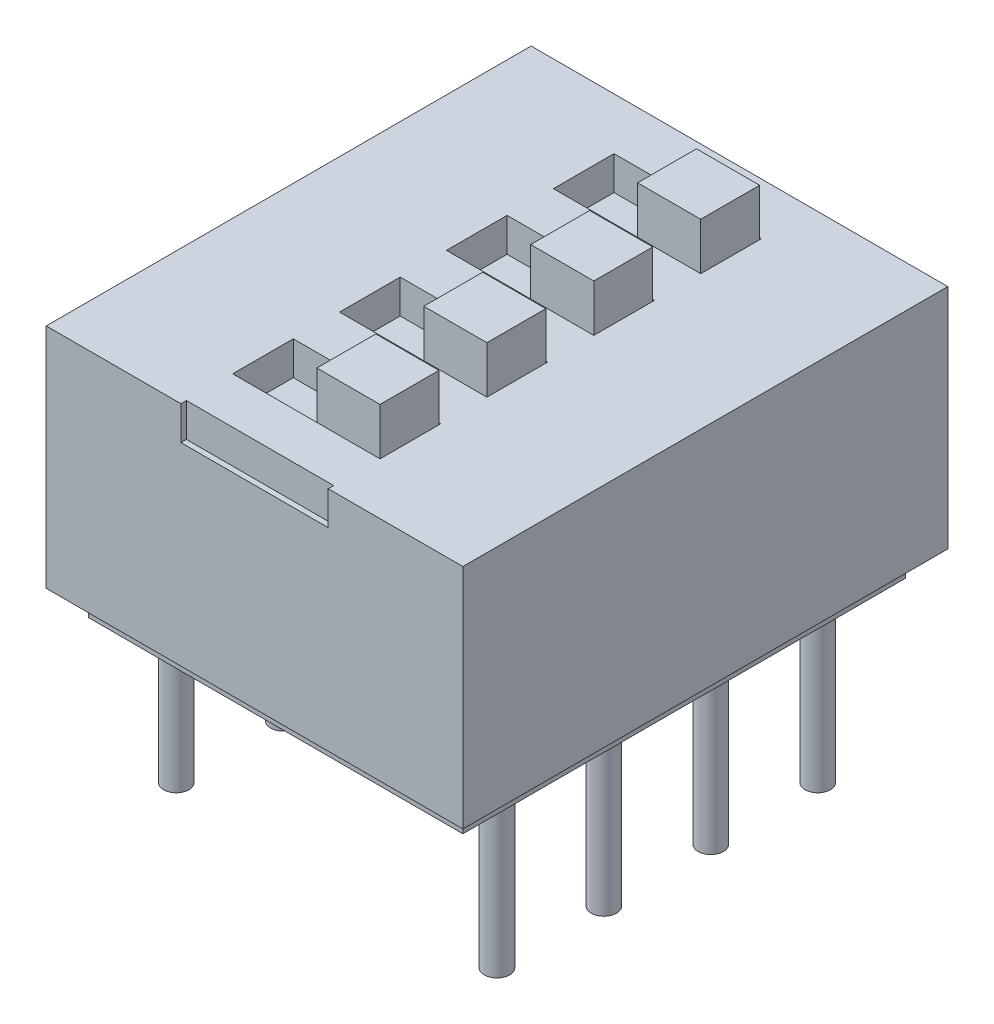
SolidWorks part; units mm, degrees
ref_plane "Plan de face" through (0, 0, 0) normal (0, 0, 1) x (1, 0, 0)
ref_plane "Plan de dessus" through (0, 0, 0) normal (0, 1, 0) x (1, 0, 0)
ref_plane "Plan de droite" through (0, 0, 0) normal (1, 0, 0) x (0, 0, -1)
sketch "Esquisse1" plane through (0, 0, 0) normal (0, 0, 1) x (1, 0, 0)
  line L0 (-9.541, 0) -> (21.5285, 0) construction
  line L1 (0, -1.2116) -> (0, 23.1187) construction
  line L2 (-4.95, -3.792) -> (-4.95, 12.2258) construction
  line L3 (-9.541, 5.4) -> (21.5285, 5.4) construction
  line L4 (4.95, -3.792) -> (4.95, 12.2258) construction
  line L6 (-4.95, 5.4) -> (4.95, 5.4)
  line L7 (-4.95, 5.4) -> (-4.95, 0)
  line L8 (-4.95, 0) -> (4.95, 0)
  line L9 (4.95, 5.4) -> (4.95, 0)
  dimension "D1" = 4.95
  dimension "D2" = 9.9
  dimension "D3" = 5.4
extrude "Boss.-Extru.1" add sketch "Esquisse1" along normal blind 11.52
sketch "Esquisse2" plane through (0, 5.4, 0) normal (0, 1, 0) x (1, 0, 0)
  line L0 (-7.5233, 0) -> (6.4204, 0) construction
  line L1 (-3.381, -1.95) -> (6.4204, -1.95) construction
  line L2 (0, 0.9083) -> (0, -14.5675) construction
  line L3 (-7.5233, -1.23) -> (3.0824, -1.23) construction
  line L4 (-1.75, 2.1221) -> (-1.75, -3.3399) construction
  line L5 (1.75, 2.1221) -> (1.75, -3.3399) construction
  line L6 (-7.5233, -2.67) -> (3.0824, -2.67) construction
  line L7 (-1.75, -3.77) -> (1.75, -3.77)
  line L8 (-1.75, -1.23) -> (1.75, -1.23)
  line L9 (-1.75, -1.23) -> (-1.75, -2.67)
  line L10 (-1.75, -2.67) -> (1.75, -2.67)
  line L11 (1.75, -1.23) -> (1.75, -2.67)
  line L12 (-1.75, -3.77) -> (-1.75, -5.21)
  line L13 (-1.75, -5.21) -> (1.75, -5.21)
  line L14 (1.75, -3.77) -> (1.75, -5.21)
  line L15 (-1.75, -6.31) -> (1.75, -6.31)
  line L16 (-1.75, -6.31) -> (-1.75, -7.75)
  line L17 (-1.75, -7.75) -> (1.75, -7.75)
  line L18 (1.75, -6.31) -> (1.75, -7.75)
  line L19 (-1.75, -8.85) -> (1.75, -8.85)
  line L20 (-1.75, -8.85) -> (-1.75, -10.29)
  line L21 (-1.75, -10.29) -> (1.75, -10.29)
  line L22 (1.75, -8.85) -> (1.75, -10.29)
  line L23 (-1.75, -11.39) -> (1.75, -11.39)
  line L24 (-1.75, -11.39) -> (-1.75, -12.83)
  line L25 (-1.75, -12.83) -> (1.75, -12.83)
  line L26 (1.75, -11.39) -> (1.75, -12.83)
  dimension "D1" = 1.95
  dimension "D2" = 1.44
  dimension "D3" = 3.5
  dimension "D4" = 1.75
  dimension "D5" = 0.72
  dimension "D6" = 5
extrude "Enlèv. mat.-Extru.1" cut sketch "Esquisse2" against normal blind 0.8
sketch "Esquisse3" plane through (0, 4.6, 0) normal (0, 1, 0) x (1, 0, 0)
  line L0 (2.2148, -1.95) -> (-0.4475, -1.95) construction
  line L1 (2.2148, -1.25) -> (-0.4012, -1.25) construction
  line L2 (2.2148, -2.65) -> (-0.3664, -2.65) construction
  line L3 (1.73, -1.0106) -> (1.73, -2.8221) construction
  line L4 (0.23, -1.0106) -> (0.23, -2.8221) construction
  line L5 (1.75, -2.67) -> (1.75, -1.23) construction
  line L6 (0.23, -3.79) -> (0.23, -5.19)
  line L7 (0.23, -1.25) -> (1.73, -1.25)
  line L8 (0.23, -1.25) -> (0.23, -2.65)
  line L9 (0.23, -2.65) -> (1.73, -2.65)
  line L10 (1.73, -1.25) -> (1.73, -2.65)
  line L11 (0.23, -3.79) -> (1.73, -3.79)
  line L12 (1.73, -3.79) -> (1.73, -5.19)
  line L13 (0.23, -5.19) -> (1.73, -5.19)
  line L14 (0.23, -6.33) -> (0.23, -7.73)
  line L15 (0.23, -6.33) -> (1.73, -6.33)
  line L16 (1.73, -6.33) -> (1.73, -7.73)
  line L17 (0.23, -7.73) -> (1.73, -7.73)
  line L18 (0.23, -8.87) -> (0.23, -10.27)
  line L19 (0.23, -8.87) -> (1.73, -8.87)
  line L20 (1.73, -8.87) -> (1.73, -10.27)
  line L21 (0.23, -10.27) -> (1.73, -10.27)
  line L26 (0.23, -11.41) -> (0.23, -12.81)
  line L27 (0.23, -11.41) -> (1.73, -11.41)
  line L28 (1.73, -11.41) -> (1.73, -12.81)
  line L29 (0.23, -12.81) -> (1.73, -12.81)
  dimension "D1" = 0.7
  dimension "D2" = 0.7
  dimension "D3" = 1.5
  dimension "D4" = 0.02
  dimension "D5" = 5
extrude "Boss.-Extru.2" add sketch "Esquisse3" along normal blind 1.9
sketch "Esquisse4" plane through (0, 0, 0) normal (0, -1, 0) x (1, 0, 0)
  line L0 (-5.7, 11.52) -> (8.3376, 11.52) construction
  line L1 (4.95, 14.7569) -> (4.95, -0.4491) construction
  line L2 (4.45, -0.4491) -> (4.45, 14.7569) construction
  line L3 (8.3376, 11.02) -> (-5.7, 11.02) construction
  line L4 (-4.45, 14.7569) -> (-4.45, -0.4491) construction
  line L5 (-5.7, 0.5) -> (8.3376, 0.5) construction
  line L6 (-4.95, 0) -> (4.95, 0) construction
  line L7 (-4.95, 11.52) -> (-4.95, 0) construction
  line L9 (-4.45, 11.02) -> (4.45, 11.02)
  line L10 (-4.45, 11.02) -> (-4.45, 0.5)
  line L11 (-4.45, 0.5) -> (4.45, 0.5)
  line L12 (4.45, 11.02) -> (4.45, 0.5)
  dimension "D1" = 0.5
  dimension "D2" = 0.5
  dimension "D3" = 0.5
  dimension "D4" = 0.5
extrude "Boss.-Extru.3" add sketch "Esquisse4" along normal blind 0.6
sketch "Esquisse5" plane through (0, -0.6, 0) normal (0, -1, 0) x (1, 0, 0)
  line L0 (0, -0.6261) -> (0, 14.5445) construction
  line L1 (5.9302, 0) -> (-2.9739, 0) construction
  line L2 (-4.95, 0) -> (4.95, 0) construction
  line L3 (5.9302, 1.95) -> (2.0534, 1.95) construction
  line L4 (3.81, -0.6261) -> (3.81, 14.5445) construction
  circle A0 centre (3.81, 1.95) radius 0.3
  circle A1 centre (3.81, 4.49) radius 0.3
  circle A2 centre (3.81, 7.03) radius 0.3
  circle A3 centre (3.81, 9.57) radius 0.3
  circle A5 centre (-3.81, 1.95) radius 0.3
  circle A6 centre (-3.81, 4.49) radius 0.3
  circle A7 centre (-3.81, 7.03) radius 0.3
  circle A8 centre (-3.81, 9.57) radius 0.3
  circle A10 centre (3.81, 12.11) radius 0.3
  circle A11 centre (3.81, 12.11) radius 0.3
  circle A12 centre (-3.81, 12.11) radius 0.3
  dimension "D3" = 5
  dimension "D1" = 1.95
  dimension "D2" = 3.81
  dimension "D4" = 2
extrude "Boss.-Extru.4" add sketch "Esquisse5" along normal blind 3.8
